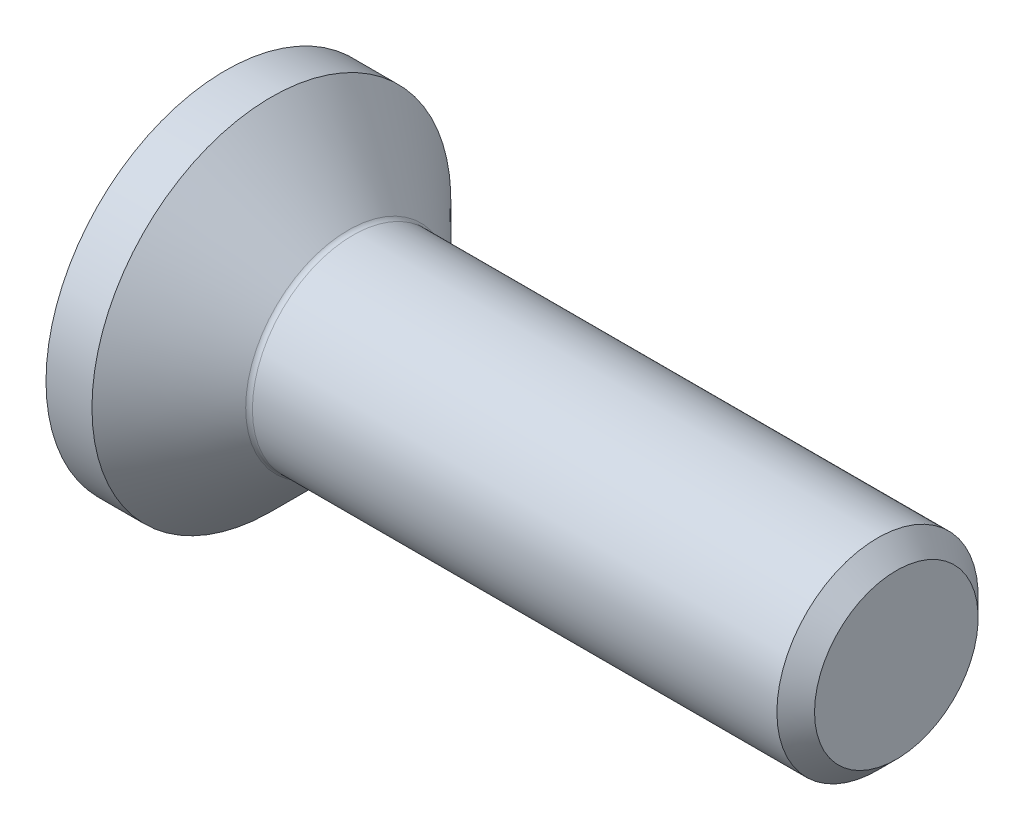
SolidWorks part; units mm, degrees
revolve "PreBroach" cut sketch "Sketch2"
sketch "Sketch2"
  line L0 (0, 1) -> (1.1, 1)
  line L1 (1.1, 1) -> (1.6774, 0)
  line L2 (0, 0) -> (127, 0) construction
  line L3 (1.6774, 0) -> (0, 0)
  line L4 (0, 0) -> (0, 1)
  line L5 (0, -1) -> (1.1, -1) construction
  line L6 (0, 0) -> (47.625, 0) construction
  line L8 (0, 2.675) -> (0, -2.675) construction
revolve "BaseBody" add sketch "BodySke" angle 360 about L6
sketch "BodySke" plane through (0, 0, 0) normal (0, 0, 1) x (1, 0, 0)
  line L0 (0, 0) -> (0, 2.675)
  line L1 (0.685, 2.675) -> (1.86, 1.5)
  line L2 (0, 2.675) -> (0.685, 2.675)
  line L3 (1.86, 1.5) -> (9.7195, 1.5)
  line L4 (10, 1.2195) -> (10, 0)
  line L5 (10, 0) -> (0, 0)
  line L6 (0, 0) -> (127, 0) construction
  line L7 (0.685, -2.675) -> (1.86, -1.5) construction
  line L8 (10, 1.2195) -> (9.7195, 1.5)
  line L9 (0, -2.675) -> (0.685, -2.675) construction
  line L10 (10, -1.2195) -> (9.7195, -1.5) construction
  line L11 (2.36, 7.85) -> (2.36, -14.375) construction
  line L12 (0, 19.05) -> (0, -3.175) construction
ref_plane "Plane1" through (0, 0, 0) normal (0, 0, 1) x (1, 0, 0)
ref_plane "Plane2" through (0, 0, 0) normal (0, 1, 0) x (1, 0, 0)
ref_plane "Plane3" through (0, 0, 0) normal (1, 0, 0) x (0, 0, -1)
fillet "Fillet1" radius 0.1 1 edges at (1.86, 0, 1.5)
sketch "Sketch3" plane through (0, 0, 0) normal (-1, 0, 0) x (0, 0, 1)
  line L0 (-1, -0.5774) -> (-1, 0.5774)
  line L1 (-1, 0.5774) -> (0, 1.1547)
  line L2 (0, 1.1547) -> (1, 0.5774)
  line L3 (1, 0.5774) -> (1, -0.5774)
  line L4 (1, -0.5774) -> (0, -1.1547)
  line L5 (0, -1.1547) -> (-1, -0.5774)
extrude "Hex" cut sketch "Sketch3" against normal blind 1.1
sketch "ThdSchSke" plane through (0, 0, 0) normal (0, 0, 1) x (1, 0, 0)
  line L0 (2.86, -1.2195) -> (2.6636, -1.5)
  line L1 (2.86, -1.2195) -> (3.0564, -1.5)
  line L2 (3.0564, -1.5) -> (3.0564, -1.875)
  line L3 (-3.175, 0) -> (5.1513, 0) construction
  line L4 (0, 2.675) -> (0, -2.675) construction
  line L5 (3.0564, -1.875) -> (2.6636, -1.875)
  line L6 (2.6636, -1.875) -> (2.6636, -1.5)
revolve "ThreadSchematic" [suppressed] cut sketch "ThdSchSke" angle 360 about L3
pattern_linear "ThdSchPat" [suppressed]
equation "\"Thread_minor@ThreadCosmetic\"  =  \"Minor_dia@BodySke\""
equation "\"D1@Sketch3\" = \"Hex_size@Sketch3\" / 2"
equation "\"D2@Sketch3\" = \"D1@Sketch3\""
equation "\"D3@Sketch3\" = \"Hex_size@Sketch3\""
equation "\"Thread_length@ThreadCosmetic\" = ((sgn( (\"Length@BodySke\" - \"Advance@BodySke\" * 2.0 - \"Head_ht@BodySke\" ) - \"Thread_nom@BodySke\" )-1)*( (\"Length@BodySke\" - \"Advance@BodySke\" * 2.0 - \"Head_ht@BodySke\" "
equation "\"Thread_minor@ThdSchSke\" = \"Minor_dia@BodySke\""
equation "\"Diameter@ThdSchSke\" = \"Diameter@BodySke\""
equation "\"Overcut@ThdSchSke\" = \"Diameter@BodySke\" * 1.25"
equation "\"Start@ThdSchSke\" = 0.000001 + \"Length@BodySke\" - \"Thread_length@ThreadCosmetic\"  '---Countersunk---"
equation "\"Num_threads@ThdSchPat\" = int( \"Thread_length@ThreadCosmetic\" / \"Advance@BodySke\" + 0.999 )  + 1"
equation "\"Advance@ThdSchPat\" = \"Thread_length@ThreadCosmetic\" /  (\"Num_threads@ThdSchPat\" - 1) 'relax it"
equation "\"Num_threads@ThdSchPat\" = \"Num_threads@ThdSchPat\" - sgn( \"Num_threads@ThdSchPat\" - 1) '---chamfered tips only---"
